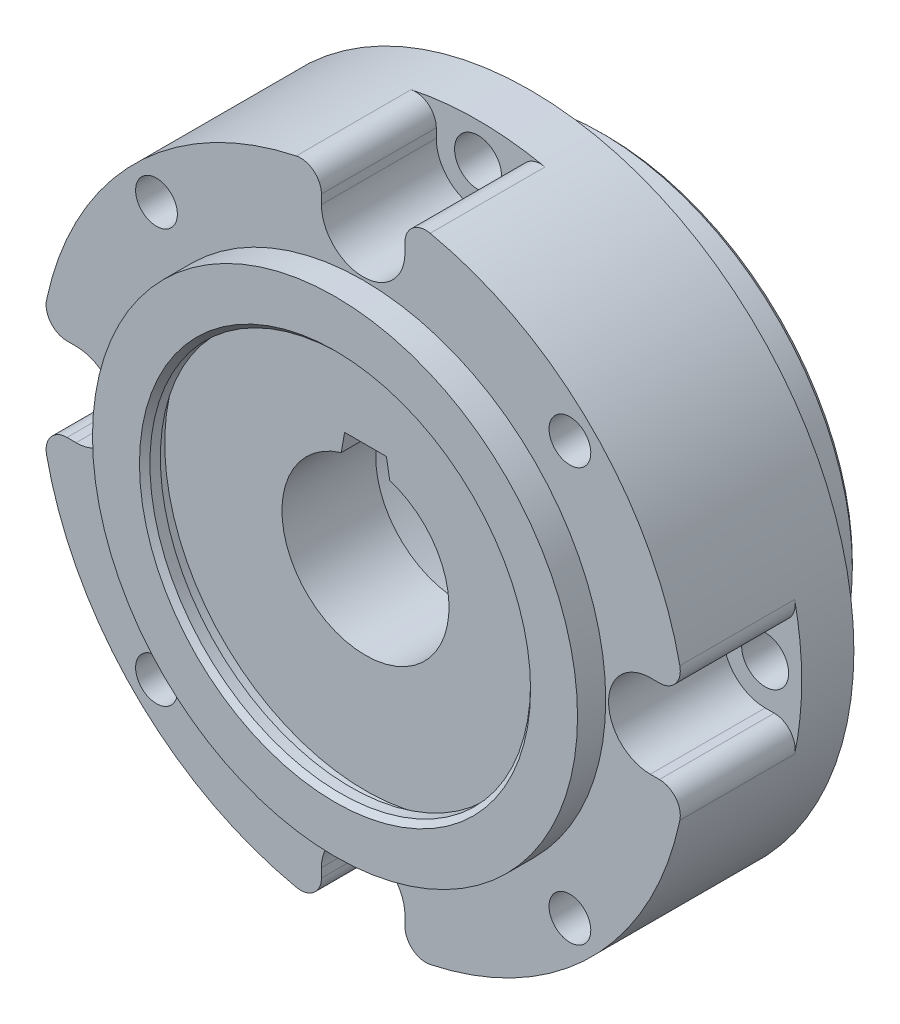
SolidWorks part; units mm, degrees
other "Chamfer1" parameters "D1"=1.1615, "D2"=22.4384, "D3"=6.5, "D4"=27.5
ref_plane "Front Plane" through (0, 0, 0) normal (0, 0, 1) x (1, 0, 0)
ref_plane "Top Plane" through (0, 0, 0) normal (0, 1, 0) x (1, 0, 0)
ref_plane "Right Plane" through (0, 0, 0) normal (1, 0, 0) x (0, 0, -1)
imported_body "Imported1"
move or copy body "Body-Move/Copy" bodies to move or copy 101 copy no translate (0, 0, -10.4999)
sketch "Reference Sketch for Original Fastener Feature"
other "DeleteFace \"Blind Hole Removal\""
other "DeleteFace \"Chamfer Removal\""
sketch "Recessed Cut Sketch"
extrude "Recessed Cut-Extrude" cut sketch "Recessed Cut Sketch" against normal blind 11
other "Move Face using the offset option" parameters "D1"=1
hole_wizard "M4 Clearance Hole" positions "Sketch3" profile "Sketch4" hole size "M4" standard "ANSI Metric"
sketch "Sketch3" plane through (0, 0, -13.7) normal (0, 0, 1) x (1, 0, 0)
  point P0 (0, 27.5)
sketch "Sketch4" plane through (0, 27.5, -13.7) normal (1, 0, 0) x (0, -1, 0)
  line L0 (0, 0) -> (0, 7.2999)
  line L1 (0, 7.2999) -> (2.25, 7.2999)
  line L2 (2.25, 7.2999) -> (2.25, 0)
  line L5 (2.25, 0) -> (0, 0)
  line L11 (0, -6.35) -> (0, 107.95) construction
  dimension "Thru Hole Dia." = 4.5
  dimension "Thru Hole Depth" = 7.2999
fillet "Cut Corner Fillets" radius 2 2 edges at (4, 30.7409, -8.2) (-4, 30.7409, -8.2)
pattern_circular "Circular Pattern of Cut, Fillet and Hole" count 4 over 360 about axis through (0, 0, 0) along (0, 0, 1) of "M4 Clearance Hole", "Recessed Cut-Extrude", "Cut Corner Fillets"
ref_plane "Reference Plane to get Angle" through (0, 0, 0) normal (-0.9063, -0.4226, 0) x (0, 0, 1)
other "Move Face Rotate 20 Degrees" parameters "D1"=20
sketch "Reference Sketch to verify blind hole placement" plane through (0, 0, -2.7) normal (0, 0, 1) x (1, 0, 0)
  line L0 (0, 0) -> (-19.799, 19.799) construction
  line L1 (0, 0) -> (0, 46.4204) construction
  line L2 (0, 0) -> (-27.5, 0) construction
  dimension "D1" = 45
  dimension "D2" = 45
other "DeleteFace Remove Chamfers"
fillet "Face Fillet to remove Chamfer(2nd Method)" radius 0.508
other "Move Face Translate" parameters "D1"=5
other "Move Face Offset (Add Material for Key way Cutout)" parameters "D1"=2.4
sketch "Sketch5" plane through (0, 0, -2.9199) normal (0, 0, 1) x (1, 0, 0)
  line L0 (0, 0) -> (0, 13.7976) construction
  line L1 (-2, 7.746) -> (-2, 9.5)
  line L2 (-2, 9.5) -> (2, 9.5)
  line L3 (2, 7.746) -> (2, 9.5)
  arc A0 (-2, 7.746) -> (2, 7.746) centre (0, 0) ccw
  point P8 (0, 9.5)
  dimension "D1" = 17.5
  dimension "D2" = 16
  dimension "D3" = 4
extrude "Key way Cutout" cut sketch "Sketch5" against normal through all contours L3 L2 L1 A0
other "Final Move Face Angle " parameters "D1"=10
other "Final Move Face Angle 2" parameters "D1"=10
equation "\"D2@Recessed Cut Sketch\" = \"D1@Reference Sketch for Original Fastener Feature\""
